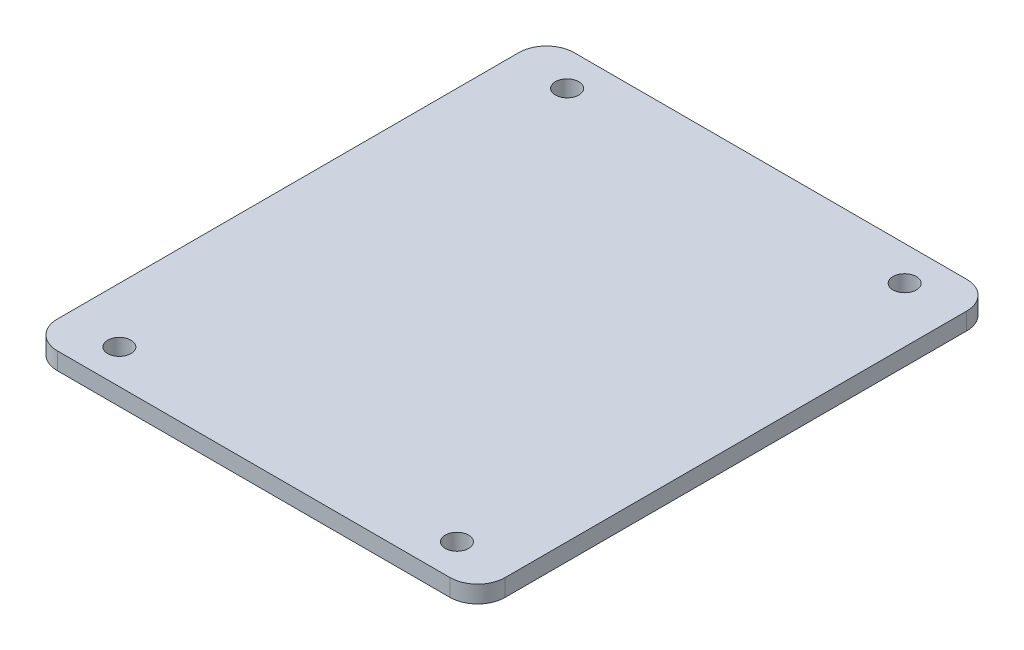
SolidWorks part; units mm, degrees
ref_plane "Front Plane" through (0, 0, 0) normal (0, 0, 1) x (1, 0, 0)
ref_plane "Top Plane" through (0, 0, 0) normal (0, 1, 0) x (1, 0, 0)
ref_plane "Right Plane" through (0, 0, 0) normal (1, 0, 0) x (0, 0, -1)
sketch "Sketch1" plane through (0, 0, 0) normal (0, 1, 0) x (1, 0, 0)
  line L1 (41.275, -47.625) -> (-41.275, -47.625)
  line L2 (41.275, -47.625) -> (41.275, 47.625)
  line L3 (41.275, 47.625) -> (-41.275, 47.625)
  line L4 (-41.275, -47.625) -> (-41.275, 47.625)
  line L5 (41.275, -47.625) -> (-41.275, 47.625) construction
  line L6 (41.275, 47.625) -> (-41.275, -47.625) construction
  point P0 (0, 0)
  dimension "D1" = 82.55
  dimension "D2" = 95.25
extrude "Main Extrusion" add sketch "Sketch1" along normal blind 3.175
sketch "Sketch2" plane through (0, 0, 0) normal (0, -1, 0) x (-1, 0, 0)
  line L1 (31.115, 41.275) -> (-31.115, 41.275) construction
  line L2 (31.115, 41.275) -> (31.115, -41.275) construction
  line L3 (31.115, -41.275) -> (-31.115, -41.275) construction
  line L4 (-31.115, 41.275) -> (-31.115, -41.275) construction
  line L5 (31.115, 41.275) -> (-31.115, -41.275) construction
  line L6 (31.115, -41.275) -> (-31.115, 41.275) construction
  circle A0 centre (-31.115, -41.275) radius 2.15
  circle A1 centre (-31.115, 41.275) radius 2.15
  circle A2 centre (31.115, 41.275) radius 2.15
  circle A3 centre (31.115, -41.275) radius 2.15
  point P0 (0, 0)
  point P14 (-33.265, -41.275)
  dimension "D3" = 4.3
  dimension "D1" = 82.55
  dimension "D2" = 62.23
extrude "Stand off holes" cut sketch "Sketch2" against normal through all
fillet "Fillet1" radius 5.08 4 edges at (41.275, 1.5875, -47.625) (-41.275, 1.5875, -47.625) (-41.275, 1.5875, 47.625) (41.275, 1.5875, 47.625)
sketch "Sketch3" plane through (0, 0, 0) normal (0, -1, 0) x (1, 0, 0)
  line L24 (-41.3512, 42.545) -> (-41.3512, -42.545)
  line L25 (-36.195, -47.7012) -> (36.195, -47.7012)
  line L26 (41.3512, -42.545) -> (41.3512, 42.545)
  line L27 (36.195, 47.7012) -> (-36.195, 47.7012)
  line L28 (-41.3512, 42.545) -> (-41.3512, -42.545)
  line L29 (-36.195, -47.7012) -> (36.195, -47.7012)
  line L30 (41.3512, -42.545) -> (41.3512, 42.545)
  line L31 (36.195, 47.7012) -> (-36.195, 47.7012)
  circle A18 centre (-31.115, 41.275) radius 2.0738
  circle A19 centre (-31.115, 41.275) radius 2.0738
  arc A20 (-36.195, 47.7012) -> (-41.3512, 42.545) centre (-36.195, 42.545) ccw
  arc A21 (-41.3512, -42.545) -> (-36.195, -47.7012) centre (-36.195, -42.545) ccw
  arc A22 (36.195, -47.7012) -> (41.3512, -42.545) centre (36.195, -42.545) ccw
  arc A23 (41.3512, 42.545) -> (36.195, 47.7012) centre (36.195, 42.545) ccw
  arc A24 (-36.195, 47.7012) -> (-41.3512, 42.545) centre (-36.195, 42.545) ccw
  arc A25 (-41.3512, -42.545) -> (-36.195, -47.7012) centre (-36.195, -42.545) ccw
  arc A26 (36.195, -47.7012) -> (41.3512, -42.545) centre (36.195, -42.545) ccw
  arc A27 (41.3512, 42.545) -> (36.195, 47.7012) centre (36.195, 42.545) ccw
  circle A29 centre (-31.115, -41.275) radius 2.0738
  circle A30 centre (-31.115, -41.275) radius 2.0738
  circle A32 centre (31.115, -41.275) radius 2.0738
  circle A33 centre (31.115, -41.275) radius 2.0738
  circle A35 centre (31.115, 41.275) radius 2.0738
  circle A36 centre (31.115, 41.275) radius 2.0738
  dimension "D1" = 0.0762
  dimension "D2" = 0.0762
  dimension "D3" = 0.0762
  dimension "D4" = 0.0762
  dimension "D5" = 0.0762
